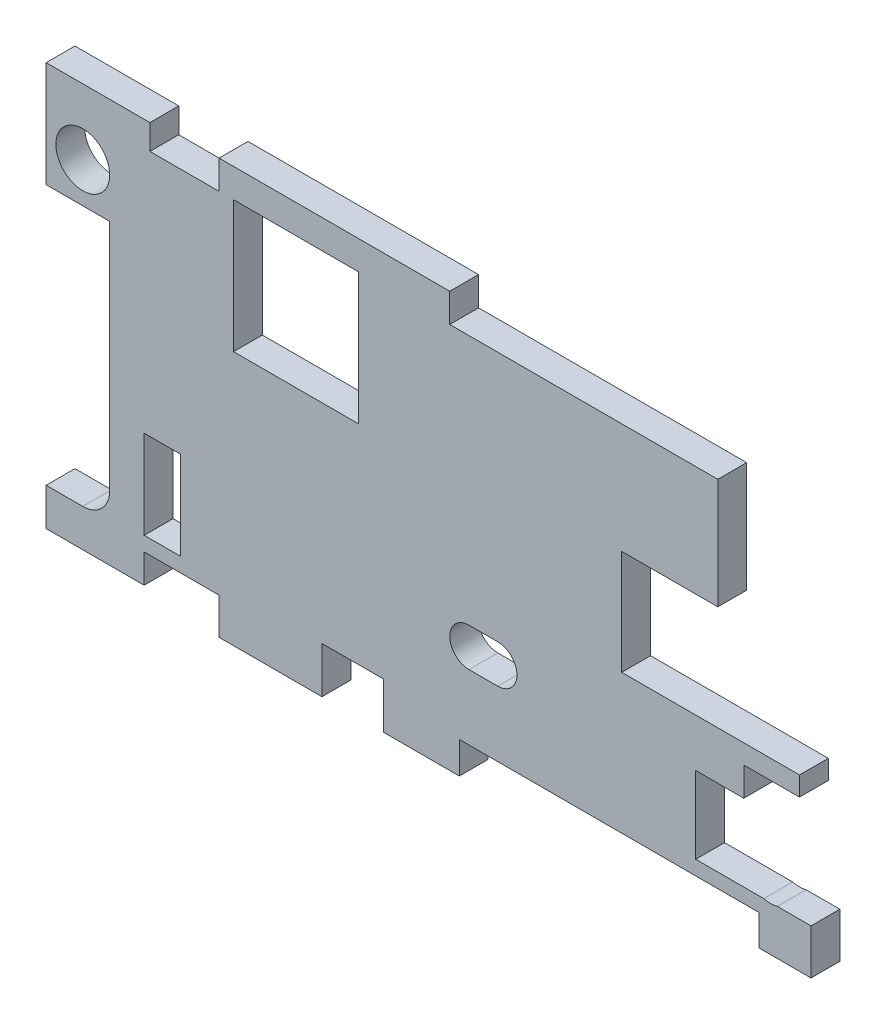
SolidWorks part; units mm, degrees
ref_plane "前视基准面" through (0, 0, 0) normal (0, 0, 1) x (1, 0, 0)
ref_plane "上视基准面" through (0, 0, 0) normal (0, 1, 0) x (1, 0, 0)
ref_plane "右视基准面" through (0, 0, 0) normal (1, 0, 0) x (0, 0, -1)
sketch "草图1" plane through (0, 0, 0) normal (0, 0, 1) x (1, 0, 0)
  line L0 (0, -12.3) -> (0, 0)
  line L1 (0, 0) -> (10.8, 0)
  line L2 (10.8, 0) -> (10.8, -2.6)
  line L3 (10.8, -2.6) -> (19.5, -2.6)
  line L4 (74.3, -2.6) -> (74.3, -11.9)
  line L5 (74.3, -11.9) -> (81.8, -11.9)
  line L6 (28.7, -38.8) -> (33.7, -38.8)
  line L7 (32.5, -2.6) -> (74.3, -2.6)
  line L8 (70.2, -42.7) -> (83.8, -42.7)
  line L10 (83.8, -11.9) -> (83.8, -42.7)
  line L12 (70.2, -42.7) -> (70.2, -32.1)
  line L13 (70.2, -32.1) -> (78.4, -32.1)
  line L14 (78.4, -32.1) -> (78.4, -14)
  line L15 (78.4, -14) -> (59.9, -14)
  line L16 (59.9, -14) -> (59.9, -25)
  line L17 (59.9, -25) -> (66.4, -25)
  line L18 (66.4, -28) -> (66.4, -40.8)
  line L19 (66.4, -40.8) -> (43, -40.8)
  line L20 (43, -40.8) -> (43, -48.8)
  line L21 (43, -48.8) -> (18, -48.8)
  line L22 (18, -48.8) -> (18, -39.3)
  line L23 (18, -39.3) -> (14, -39.3)
  line L24 (14, -39.3) -> (14, -28.3)
  line L25 (14, -28.3) -> (10.2, -28.3)
  line L26 (0, -12.3) -> (6.4, -12.3)
  line L27 (6.4, -12.3) -> (6.4, -32.3)
  line L28 (6.4, -32.3) -> (0, -32.3)
  line L29 (0, -32.3) -> (0, -44.3)
  line L30 (0, -44.3) -> (10.2, -44.3)
  line L31 (10.2, -44.3) -> (10.2, -28.3)
  line L33 (66.4, -25) -> (69.4, -25)
  line L35 (83.8, -11.9) -> (81.8, -11.9)
  line L37 (66.4, -28) -> (69.4, -28)
  line L38 (69.4, -25) -> (69.4, -28)
  line L39 (28.7, -38.8) -> (28.7, -42.8)
  line L40 (28.7, -42.8) -> (33.7, -42.8)
  line L41 (33.7, -38.8) -> (33.7, -42.8)
  line L42 (19.5, -2.6) -> (19.5, -16.3)
  line L43 (19.5, -16.3) -> (32.5, -16.3)
  line L44 (32.5, -16.3) -> (32.5, -2.6)
  circle A0 centre (3.81, -6.84) radius 2.8
  circle A2 centre (75.39, -35.29) radius 2.8
  circle A3 centre (3.81, -35.29) radius 2.8
  arc A4 (73.646, -4.6495) -> (73.646, -9.0305) centre (75.39, -6.84) ccw
  dimension "D32" = 5.6
  dimension "D33" = 3.81
  dimension "D6" = 6.84
  dimension "D1" = 12.3
  dimension "D2" = 10.8
  dimension "D3" = 2.6
  dimension "D4" = 8.7
  dimension "D5" = 13.7
  dimension "D7" = 2
  dimension "D8" = 2
  dimension "D9" = 13.7
  dimension "D10" = 3
  dimension "D11" = 3
  dimension "D12" = 10.6
  dimension "D14" = 8.2
  dimension "D16" = 23.9
  dimension "D17" = 11
  dimension "D18" = 3.8
  dimension "D19" = 15.8
  dimension "D20" = 23.4
  dimension "D21" = 8
  dimension "D22" = 25
  dimension "D23" = 9.5
  dimension "D24" = 4
  dimension "D25" = 11
  dimension "D26" = 3.8
  dimension "D27" = 6.4
  dimension "D28" = 20
  dimension "D29" = 12
  dimension "D30" = 2
  dimension "D34" = 13
  dimension "D35" = 5
  dimension "D36" = 4
  dimension "D37" = 6
  dimension "D38" = 9.3
extrude "凸台-拉伸1" add sketch "草图1" along normal blind 3
sketch "草图2" plane through (0, 0, 3) normal (0, 0, 1) x (1, 0, 0)
  line L1 (14, -39.3) -> (18, -39.3)
  line L2 (14, -39.3) -> (14, -39)
  line L3 (14, -39) -> (18, -39)
  line L4 (18, -39.3) -> (18, -39)
  line L5 (66.4, -40.8) -> (43, -40.8)
  line L6 (66.4, -40.8) -> (66.4, -39.5)
  line L7 (66.4, -39.5) -> (43, -39.5)
  line L8 (43, -40.8) -> (43, -39.5)
  line L9 (0, -12.3) -> (6.4, -12.3)
  line L10 (0, -12.3) -> (0, -11)
  line L11 (0, -11) -> (6.4, -11)
  line L12 (6.4, -12.3) -> (6.4, -11)
  line L13 (70.2, -42.7) -> (83.8, -42.7) construction
  line L14 (70.2, -32.1) -> (73.2, -32.1)
  line L15 (70.2, -32.1) -> (70.2, -42.7)
  line L16 (70.2, -42.7) -> (73.2, -42.7)
  line L17 (33.7, -38.8) -> (28.7, -38.8) construction
  line L18 (28.7, -42.8) -> (35.1, -42.8)
  line L19 (28.7, -42.8) -> (28.7, -38)
  line L20 (28.7, -38) -> (35.1, -38)
  line L21 (35.1, -42.8) -> (35.1, -38)
  line L22 (33.7, -42.8) -> (33.7, -38.8) construction
  line L23 (10.2, -44.3) -> (10.2, -28.3) construction
  line L24 (0, -44.3) -> (10.2, -44.3)
  line L25 (0, -44.3) -> (0, -42)
  line L26 (0, -42) -> (10.2, -42)
  line L27 (10.2, -44.3) -> (10.2, -42)
  line L28 (73.2, -32.1) -> (73.2, -42.7)
  line L30 (59.9, -14) -> (78.4, -14)
  line L31 (59.9, -14) -> (59.9, -2.6)
  line L32 (59.9, -2.6) -> (78.4, -2.6)
  line L33 (78.4, -14) -> (78.4, -2.6)
  line L34 (83.8, -42.7) -> (83.8, -11.9) construction
  dimension "D1" = 0.3
  dimension "D2" = 4
  dimension "D3" = 1.3
  dimension "D4" = 23.4
  dimension "D5" = 1.3
  dimension "D6" = 6.4
  dimension "D7" = 3
  dimension "D8" = 0.8
  dimension "D9" = 1.4
  dimension "D10" = 2.3
  dimension "D11" = 11.4
  dimension "D12" = 5.4
extrude "切除-拉伸1" cut sketch "草图2" against normal blind 10
sketch "草图4" plane through (0, 0, 3) normal (0, 0, 1) x (1, 0, 0)
  line L0 (10.2, -42) -> (10.2, -28.3) construction
  line L1 (14, -39) -> (10.2, -39)
  line L2 (14, -39) -> (14, -37.5)
  line L3 (14, -37.5) -> (10.2, -37.5)
  line L4 (10.2, -39) -> (10.2, -37.5)
  line L6 (72.6, -27) -> (72.6, -30)
  line L7 (72.6, -30) -> (67.6, -30)
  line L8 (67.6, -30) -> (67.6, -38)
  line L9 (67.6, -38) -> (73.2, -38)
  line L10 (73.2, -42.7) -> (73.2, -37.0347) construction
  line L11 (73.2, -38) -> (73.2, -39.5)
  line L12 (73.2, -39.5) -> (66.4, -39.5)
  line L13 (66.4, -39.5) -> (66.4, -25)
  line L14 (69.4, -25) -> (59.9, -25) construction
  line L15 (66.4, -25) -> (69.4, -25)
  line L16 (69.4, -28) -> (69.4, -25) construction
  line L17 (66.4, -28) -> (69.4, -28) construction
  line L18 (78.4, -11.9) -> (78.4, -32.1) construction
  line L19 (69.4, -25) -> (78.4, -25)
  line L20 (59.9, -2.6) -> (69.9, -2.6)
  line L21 (72.6, -27) -> (78.4, -27)
  line L22 (78.4, -25) -> (78.4, -27)
  line L23 (59.9, -2.6) -> (59.9, -12.6)
  line L24 (59.9, -12.6) -> (69.9, -12.6)
  line L25 (69.9, -2.6) -> (69.9, -12.6)
  dimension "D1" = 3.2
  dimension "D2" = 2
  dimension "D3" = 1.2
  dimension "D4" = 1.5
  dimension "D5" = 1.5
  dimension "D6" = 2
  dimension "D7" = 10
  dimension "D8" = 10
extrude "凸台-拉伸3" add sketch "草图4" against normal up to vertex (3 mm away)
combine bodies "组合2" operation type add bodies to combine 109 110
sketch "草图5" plane through (0, 0, 3) normal (0, 0, 1) x (1, 0, 0)
  line L1 (43, -48.8) -> (43, -39.5) construction
  line L2 (18, -48.8) -> (43, -48.8)
  line L3 (18, -48.8) -> (18, -42.8)
  line L4 (18, -42.8) -> (43, -42.8)
  line L5 (43, -48.8) -> (43, -42.8)
  line L7 (78.4, -11.9) -> (83.8, -11.9)
  line L8 (78.4, -11.9) -> (78.4, -42.7)
  line L9 (78.4, -42.7) -> (83.8, -42.7)
  line L10 (83.8, -11.9) -> (83.8, -42.7)
  dimension "D1" = 6
extrude "切除-拉伸2" cut sketch "草图5" against normal blind 10
sketch "草图6" plane through (0, 0, 3) normal (0, 0, 1) x (1, 0, 0)
  line L1 (78.4, -32.1) -> (79.6, -32.1)
  line L2 (78.4, -32.1) -> (78.4, -42.7)
  line L3 (78.4, -42.7) -> (79.6, -42.7)
  line L4 (79.6, -32.1) -> (79.6, -42.7)
  line L5 (59.9, -12.6) -> (69.9, -12.6)
  line L6 (69.9, -2.6) -> (32.5, -2.6) construction
  line L7 (18, 0.4) -> (42, 0.4)
  line L8 (18, 0.4) -> (18, -2.6)
  line L9 (18, -2.6) -> (42, -2.6)
  line L10 (42, 0.4) -> (42, -2.6)
  line L11 (19.5, -16.3) -> (19.5, -2.6) construction
  line L12 (59.9, -12.6) -> (59.9, -14.1)
  line L13 (59.9, -14.1) -> (69.9, -14.1)
  line L14 (69.9, -12.6) -> (69.9, -14.1)
  dimension "D1" = 10.6
  dimension "D2" = 1.2
  dimension "D3" = 24
  dimension "D4" = 1.5
  dimension "D5" = 3
  dimension "D6" = 1.5
  dimension "D7" = 10
extrude "凸台-拉伸4" add sketch "草图6" against normal up to surface (3 mm away)
sketch "草图7" plane through (0, 0, 3) normal (0, 0, 1) x (1, 0, 0)
  line L1 (0, -32.3) -> (6.4, -32.29)
  line L2 (6.61, -35.29) -> (6.61, -32.29)
  line L4 (3.81, -38.09) -> (0, -38.09)
  line L5 (73.2, -38) -> (79.6, -38)
  line L6 (73.2, -38) -> (73.2, -32.1)
  line L7 (73.2, -32.1) -> (79.6, -32.1)
  line L8 (79.6, -38) -> (79.6, -32.1)
  line L9 (6.4, -11) -> (6.61, -11)
  line L10 (6.4, -11) -> (6.4, -32.29)
  line L12 (6.61, -11) -> (6.61, -32.29)
  line L13 (0, -32.3) -> (0, -42) construction
  line L14 (0, -38.09) -> (0, -32.3)
  circle A0 centre (3.81, -35.29) radius 2.8 construction
  arc A1 (3.81, -38.09) -> (6.61, -35.29) centre (3.81, -35.29) ccw
extrude "切除-拉伸3" cut sketch "草图7" against normal through all
sketch "草图8" plane through (0, 0, 3) normal (0, 0, 1) x (1, 0, 0)
  line L0 (44, -30.7) -> (47, -30.7) construction
  line L1 (44, -28.7) -> (47, -28.7)
  line L2 (44, -32.7) -> (47, -32.7)
  arc A0 (44, -28.7) -> (44, -32.7) centre (44, -30.7) ccw
  arc A1 (47, -32.7) -> (47, -28.7) centre (47, -30.7) ccw
  point P4 (45.5, -30.7)
  dimension "D1" = 2
extrude "切除-拉伸4" cut sketch "草图8" against normal blind 10
sketch "草图9" plane through (0, 0, 3) normal (0, 0, 1) x (1, 0, 0)
  line L1 (73.2, -42.7) -> (74.2, -42.7)
  line L2 (73.2, -42.7) -> (73.2, -39.5)
  line L3 (73.2, -39.5) -> (74.2, -39.5)
  line L4 (74.2, -42.7) -> (74.2, -39.5)
extrude "切除-拉伸5" cut sketch "草图9" against normal blind 10
